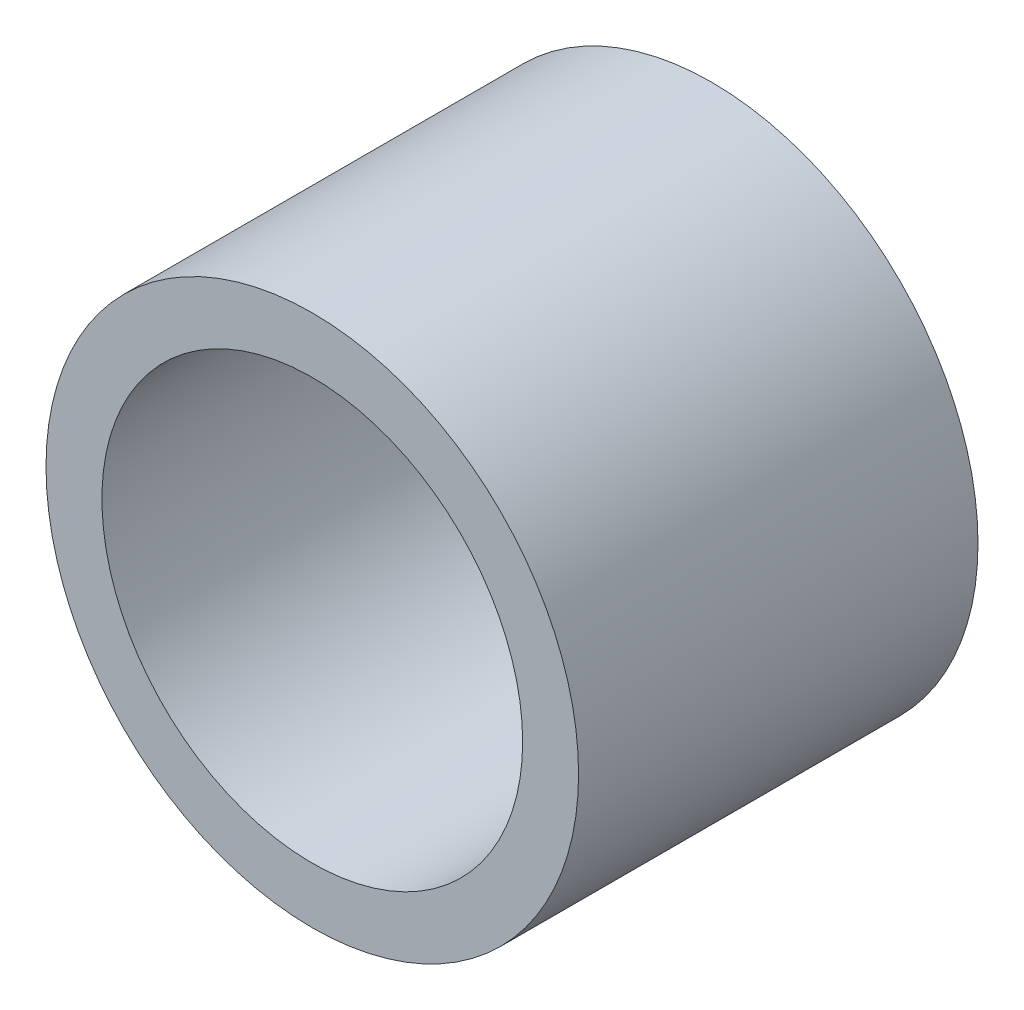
SolidWorks part; units mm, degrees
ref_plane "Front Plane" through (0, 0, 0) normal (0, 0, 1) x (1, 0, 0)
ref_plane "Top Plane" through (0, 0, 0) normal (0, 1, 0) x (1, 0, 0)
ref_plane "Right Plane" through (0, 0, 0) normal (1, 0, 0) x (0, 0, -1)
sketch "Sketch1" plane through (0, 0, 0) normal (0, 0, 1) x (1, 0, 0)
  circle A0 centre (0, 0) radius 25.4
  dimension "D1" = 50.8
extrude "cap" add sketch "Sketch1" along normal blind 38.1
sketch "Sketch2" plane through (0, 0, 38.1) normal (0, 0, 1) x (1, 0, 0)
  circle A0 centre (0, 0) radius 20.066
  dimension "D1" = 40.132
extrude "cbore" cut sketch "Sketch2" against normal blind 30.988
sketch "Sketch3" plane through (0, 0, 0) normal (0, 0, -1) x (-1, 0, 0)
  line L0 (0, 0) -> (7.62, 0) construction
  line L1 (7.62, 0) -> (7.62, 12.7) construction
  circle A0 centre (7.62, 12.7) radius 2.413
  circle A1 centre (7.62, -12.7) radius 2.413
  dimension "D3" = 4.826
  dimension "D1" = 7.62
  dimension "D2" = 12.7
extrude "mount_holes" cut sketch "Sketch3" against normal blind 30.988
sketch "Sketch4" plane through (0, 0, 0) normal (0, 0, -1) x (-1, 0, 0)
  line L0 (0, 0) -> (13.2623, 0) construction
  circle A0 centre (7.62, 12.7) radius 4.064
  circle A1 centre (7.62, -12.7) radius 4.064
  dimension "D1" = 8.128
extrude "mount_cbore" cut sketch "Sketch4" against normal blind 1.524
